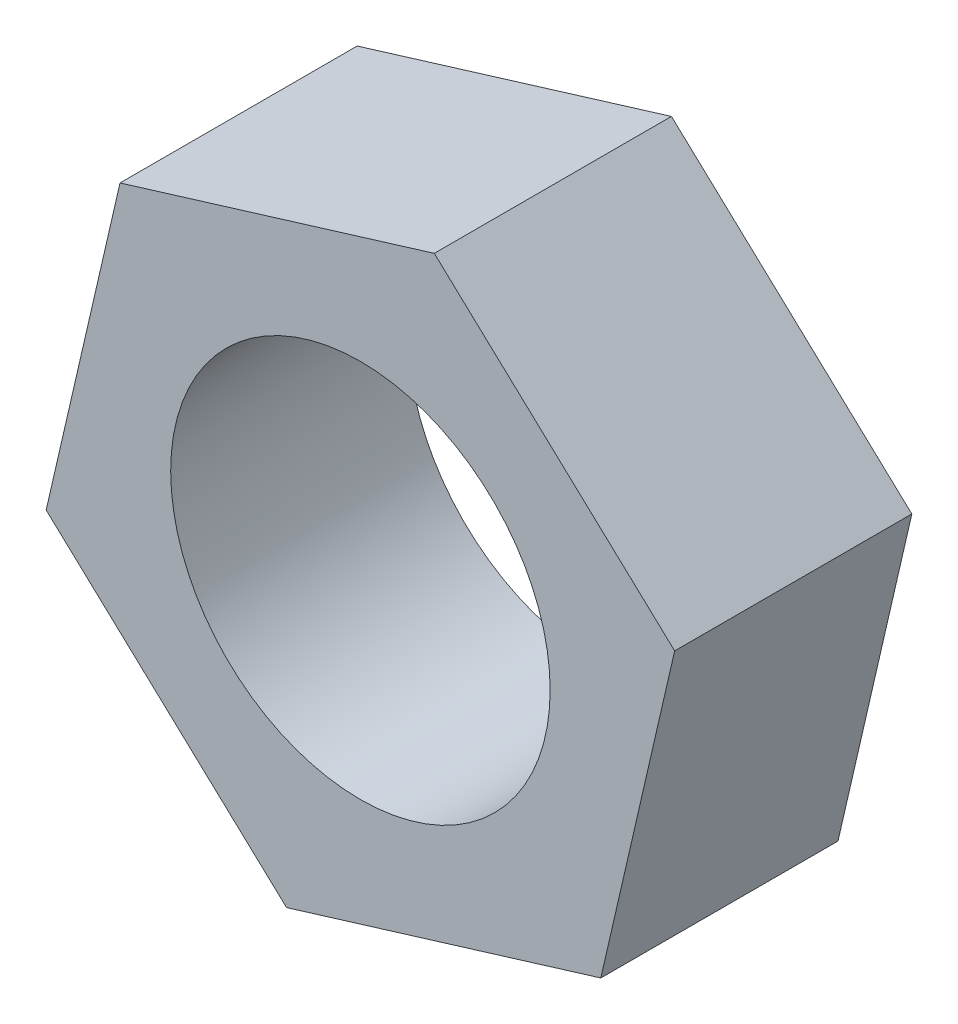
SolidWorks part; units mm, degrees
ref_plane "Front Plane" through (0, 0, 0) normal (0, 0, 1) x (1, 0, 0)
ref_plane "Top Plane" through (0, 0, 0) normal (0, 1, 0) x (1, 0, 0)
ref_plane "Right Plane" through (0, 0, 0) normal (1, 0, 0) x (0, 0, -1)
sketch "Sketch1" plane through (0, 0, 0) normal (0, 0, 1) x (1, 0, 0)
  line L1 (6.4364, -5.9993) -> (8.4138, 2.5744)
  line L2 (8.4138, 2.5744) -> (1.9774, 8.5737)
  line L3 (1.9774, 8.5737) -> (-6.4364, 5.9993)
  line L4 (-6.4364, 5.9993) -> (-8.4138, -2.5744)
  line L5 (-8.4138, -2.5744) -> (-1.9774, -8.5737)
  line L6 (-1.9774, -8.5737) -> (6.4364, -5.9993)
  circle A0 centre (0, 0) radius 7.62 construction
  circle A1 centre (0, 0) radius 5.08
extrude "Boss-Extrude1" add sketch "Sketch1" along normal blind 6.35
